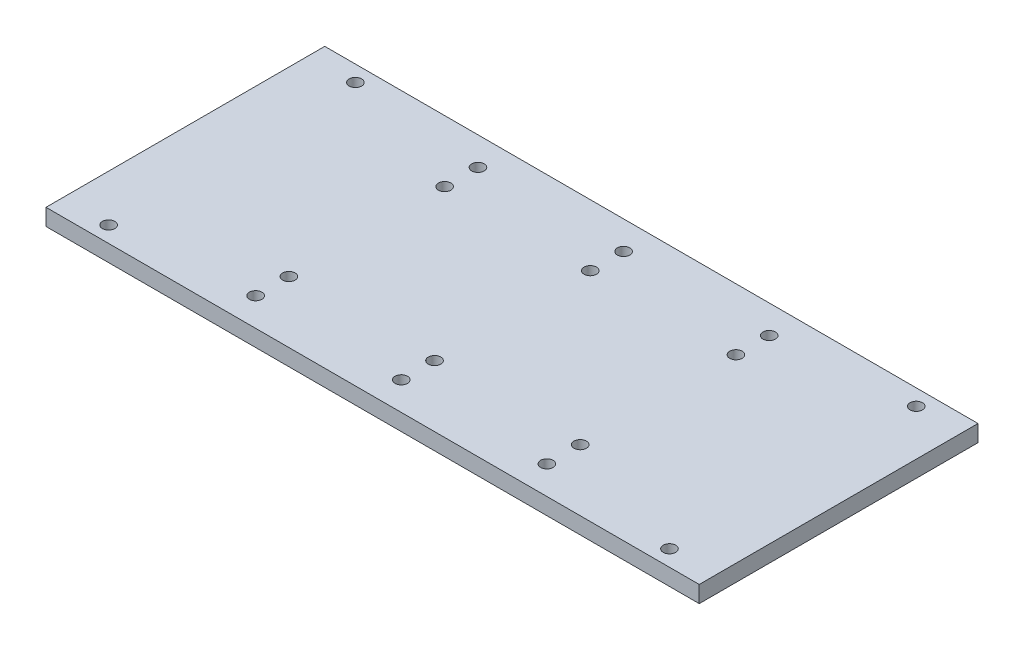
SolidWorks part; units mm, degrees
ref_plane "前视基准面" through (0, 0, 0) normal (0, 0, 1) x (1, 0, 0)
ref_plane "上视基准面" through (0, 0, 0) normal (0, 1, 0) x (1, 0, 0)
ref_plane "右视基准面" through (0, 0, 0) normal (1, 0, 0) x (0, 0, -1)
sketch "草图1" plane through (0, 0, 0) normal (0, 1, 0) x (1, 0, 0)
  line L1 (-78.5, -33.5) -> (78.5, -33.5)
  line L2 (-78.5, -33.5) -> (-78.5, 33.5)
  line L3 (-78.5, 33.5) -> (78.5, 33.5)
  line L4 (78.5, -33.5) -> (78.5, 33.5)
  line L5 (-78.5, -33.5) -> (78.5, 33.5) construction
  line L6 (-78.5, 33.5) -> (78.5, -33.5) construction
  point P0 (0, 0)
  dimension "D1" = 67
  dimension "D2" = 157
extrude "凸台-拉伸1" add sketch "草图1" along normal blind 4
extrude "切除-拉伸8" cut sketch "草图9" against normal blind 20
sketch "草图9" plane through (-3.8989, -3, 127.6181) normal (0, -1, 0) x (-1, 0, 0)
  line L1 (-3.8989, 161.1181) -> (-3.8989, 143.2827) construction
  circle A0 centre (-71.3989, 157.2758) radius 1.5
  circle A1 centre (63.3989, 157.2758) radius 1.5
extrude "切除-拉伸9" cut sketch "草图10" against normal blind 20
sketch "草图10" plane through (-3.8989, 0, -151.7977) normal (0, -1, 0) x (1, 0, 0)
  circle A0 centre (71.3989, 181.4553) radius 1.5
  circle A1 centre (-63.3989, 181.4553) radius 1.5
extrude "切除-拉伸10" cut sketch "草图11" against normal blind 20
sketch "草图11" plane through (-3.8989, 4, 127.6181) normal (0, 1, 0) x (1, 0, 0)
  circle A0 centre (-31, 108.9027) radius 1.5
  circle A1 centre (4, 108.9027) radius 1.5
  circle A2 centre (39, 108.9027) radius 1.5
  circle A3 centre (-31, 100.9027) radius 1.5
  circle A4 centre (4, 100.9027) radius 1.5
  circle A5 centre (39, 100.9027) radius 1.5
sketch "草图12" plane through (0, 4, 0) normal (0, 1, 0) x (1, 0, 0)
  circle A0 centre (35.1011, 18.7154) radius 1.5
  circle A1 centre (0.1011, 18.7154) radius 1.5
  circle A2 centre (-34.8989, 18.7154) radius 1.5
  circle A3 centre (-34.8989, 26.7154) radius 1.5
  circle A4 centre (0.1011, 26.7154) radius 1.5
  circle A5 centre (35.1011, 26.7154) radius 1.5
  dimension "D1" = 3
  dimension "D2" = 3
  dimension "D3" = 3
  dimension "D4" = 2
extrude "切除-拉伸11" cut sketch "草图12" against normal blind 20
